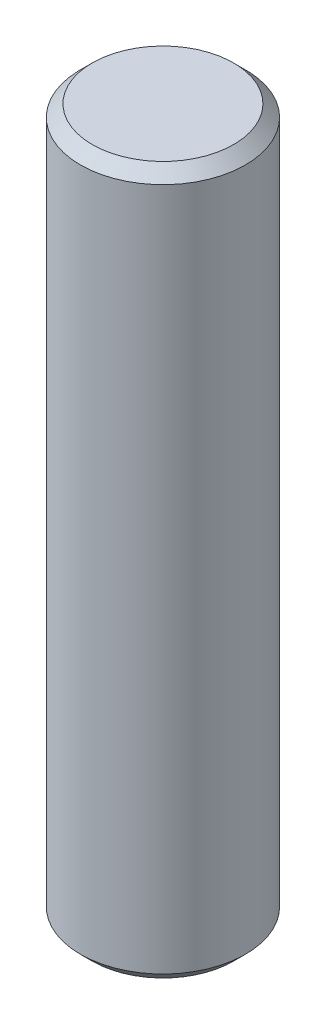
SolidWorks part; units mm, degrees
ref_plane "Plan de face" through (0, 0, 0) normal (0, 0, 1) x (1, 0, 0)
ref_plane "Plan de dessus" through (0, 0, 0) normal (0, 1, 0) x (1, 0, 0)
ref_plane "Plan de droite" through (0, 0, 0) normal (1, 0, 0) x (0, 0, -1)
sketch "Esquisse1" plane through (0, 0, 0) normal (0, 1, 0) x (1, 0, 0)
  circle A0 centre (0, 0) radius 7
  dimension "D1" = 14
extrude "Boss.-Extru.1" add sketch "Esquisse1" against normal blind 60
chamfer "Chanfrein1" distance 1 angle 45 2 edges at (0, -60, 7) (0, 0, 7)
